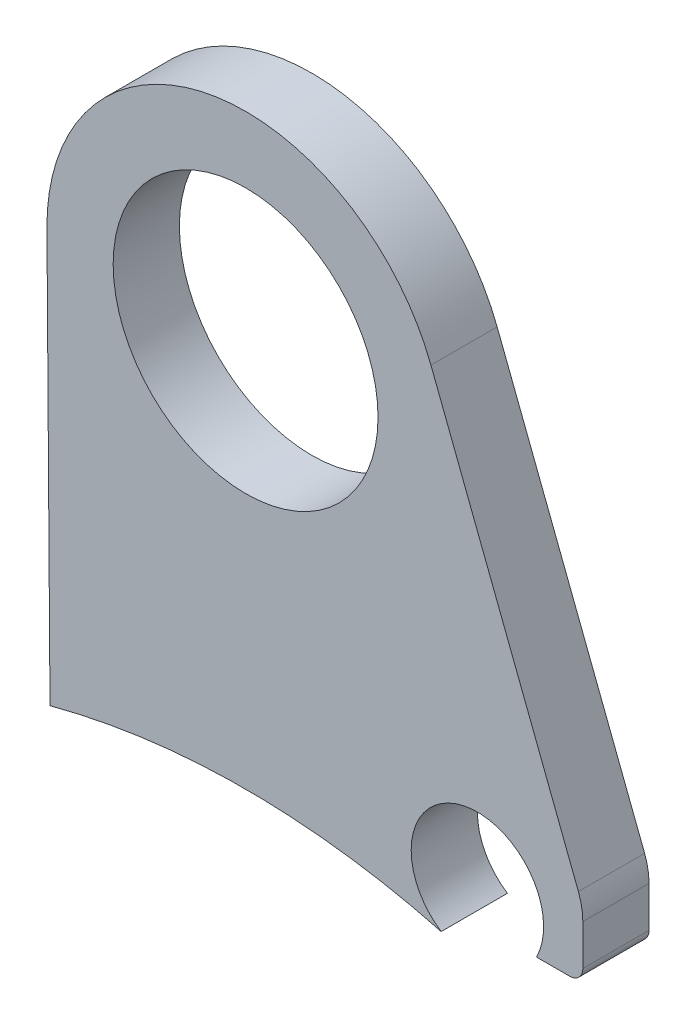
SolidWorks part; units mm, degrees
ref_plane "Front Plane" through (0, 0, 0) normal (0, 0, 1) x (1, 0, 0)
ref_plane "Top Plane" through (0, 0, 0) normal (0, 1, 0) x (1, 0, 0)
ref_plane "Right Plane" through (0, 0, 0) normal (1, 0, 0) x (0, 0, -1)
sketch "Sketch1" plane through (0, 0, 0) normal (0, 0, 1) x (1, 0, 0)
  line L0 (-0.3823, 3.4062) -> (-0.3361, -2.8226)
  line L1 (7.0106, -2.4368) -> (7.7106, -2.4368)
  line L2 (7.7106, -2.4368) -> (7.7106, -1.4368)
  line L3 (7.7106, -1.4368) -> (5.4165, 4.5084)
  line L4 (14.2874, -2.8226) -> (-6.0228, -2.8226) construction
  line L5 (2.6177, 3.4284) -> (2.6177, -9.1435) construction
  arc A0 (-0.3361, -2.8226) -> (5.5714, -2.8226) centre (2.6177, -13.9368) cw
  arc A1 (5.5714, -2.8226) -> (7.0106, -2.4368) centre (6.1183, -1.9853) cw
  arc A2 (5.4165, 4.5084) -> (-0.3823, 3.4062) centre (2.6177, 3.4284) ccw
  circle A3 centre (2.6177, 3.4284) radius 2
  dimension "D1" = 4
  dimension "D2" = 6.2288
  dimension "D4" = 1
  dimension "D7" = 11.5
  dimension "D8" = 1
  dimension "D5" = 1
  dimension "D6" = 0.7
extrude "Boss-Extrude2" add sketch "Sketch1" along normal blind 1
fillet "Fillet1" radius 1 1 edges at (7.7106, -1.4368, 0.5)
fillet "Fillet2" radius 0.2 1 edges at (7.7106, -2.4368, 0.5)
